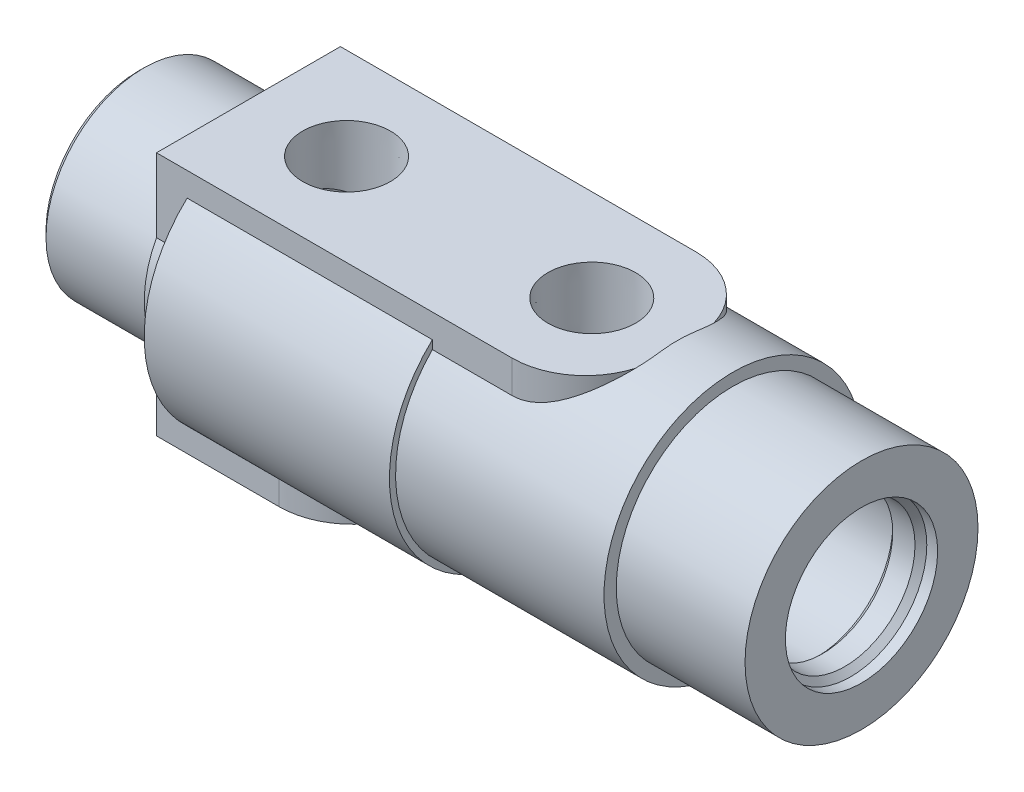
SolidWorks part; units mm, degrees
ref_plane "Front Plane" through (0, 0, 0) normal (0, 0, 1) x (1, 0, 0)
ref_plane "Top Plane" through (0, 0, 0) normal (0, 1, 0) x (1, 0, 0)
ref_plane "Right Plane" through (0, 0, 0) normal (1, 0, 0) x (0, 0, -1)
imported_body "Imported1"
hole_wizard "1/2 NPT Tapped Hole1" positions "Sketch1" profile "Sketch3" size "1/2" standard "ANSI Inch"
sketch "Sketch1" plane through (-93.6498, 0, 0) normal (-1, 0, 0) x (0, 0, 1)
  point P0 (0, 0)
sketch "Sketch3" plane through (-93.6498, 0, 0) normal (0, 1, 0) x (0, 0, 1)
  line L0 (0, 0) -> (0, 36.4998)
  line L1 (8.9281, 36.4998) -> (0, 36.4998)
  line L2 (-8.9281, 36.4998) -> (0, 36.4998) construction
  line L3 (8.9281, 36.4998) -> (8.9281, 13.5636)
  line L4 (8.9281, 13.5636) -> (10.2617, 13.5636)
  line L5 (10.2617, 13.5636) -> (10.6678, 0)
  line L6 (-10.2617, 13.5636) -> (-10.6678, 0) construction
  line L7 (10.6678, 0) -> (0, 0)
  line L8 (0, -6.35) -> (0, 107.95) construction
  line L11 (-8.9281, 13.5636) -> (-10.2617, 13.5636) construction
  dimension "Tap Drill Dia." = 17.8562
  dimension "Tap Drill Depth" = 36.4998
  dimension "Thread Dia." = 21.3355
  dimension "Thread Angle" = 3.43
  dimension "Thread Depth" = 13.5636
  dimension "Drill Angle" = 180
hole_wizard "3/8 NPT Tapped Hole1" positions "Sketch4" profile "Sketch5" size "3/8" standard "ANSI Inch"
sketch "Sketch4" plane through (-57.15, 0, 0) normal (-1, 0, 0) x (0, 0, 1)
  point P0 (0, 0)
sketch "Sketch5" plane through (-57.15, 0, 0) normal (0, 1, 0) x (0, 0, 1)
  line L0 (0, 0) -> (0, 57.15)
  line L1 (0, 57.15) -> (7.1374, 57.15)
  line L2 (-8.2632, 10.3378) -> (-8.5727, 0) construction
  line L3 (7.1374, 57.15) -> (7.1374, 10.3378)
  line L4 (7.1374, 10.3378) -> (8.2632, 10.3378)
  line L5 (8.2632, 10.3378) -> (8.5727, 0)
  line L7 (8.5727, 0) -> (0, 0)
  line L8 (0, -6.35) -> (0, 107.95) construction
  line L11 (-7.1374, 10.3378) -> (-8.2632, 10.3378) construction
  dimension "Thru Tap Drill Dia." = 14.2748
  dimension "Thru Tap Drill Depth" = 57.15
  dimension "Thread Dia." = 17.1455
  dimension "Thread Angle" = 3.43
  dimension "Thread Depth" = 10.3378
